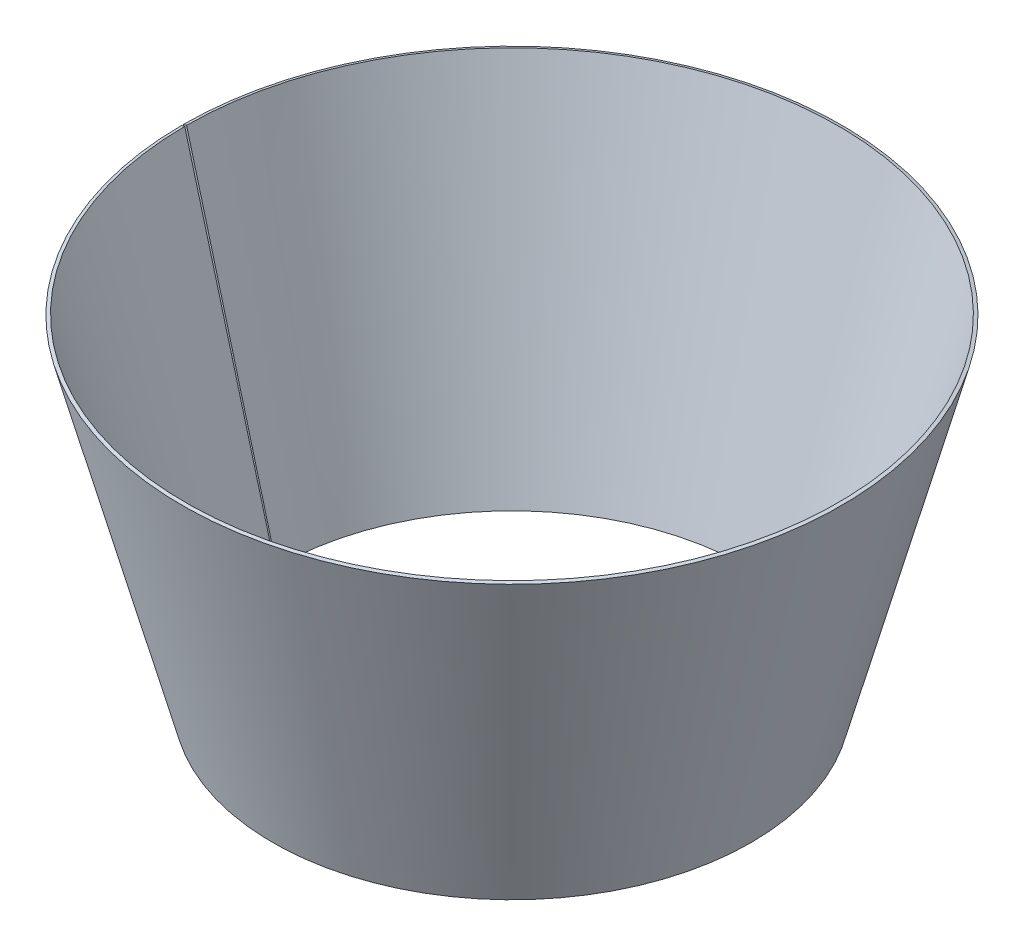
SolidWorks part; units mm, degrees
ref_plane "Ebene vorne" through (0, 0, 0) normal (0, 0, 1) x (1, 0, 0)
ref_plane "Ebene oben" through (0, 0, 0) normal (0, 1, 0) x (1, 0, 0)
ref_plane "Ebene rechts" through (0, 0, 0) normal (1, 0, 0) x (0, 0, -1)
sketch "Skizze1" plane through (0, 0, 0) normal (0, 0, 1) x (1, 0, 0)
  line L0 (0, 0) -> (0, 100) construction
  line L1 (-96.7949, 100) -> (-70, 0)
  line L2 (0, 0) -> (-70, 0) construction
  dimension "D1" = 100
  dimension "D2" = 15
  dimension "D3" = 70
revolve "Rotation-Dünn1" add sketch "Skizze1" angle 360 about L0
sketch "Skizze2" plane through (0, 0, 0) normal (0, 1, 0) x (1, 0, 0)
  line L0 (0, 0) -> (-96.7949, 0) construction
  line L1 (-171.9387, 0.5) -> (0, 0)
  line L2 (-171.9387, 0.5) -> (-171.9387, -0.5)
  line L3 (-171.9387, -0.5) -> (0, 0)
  circle A0 centre (0, 0) radius 96.7949 construction
  dimension "D1" = 1
extrude "Schnitt-Linear austragen2" cut sketch "Skizze2" along normal through all and the other way through all
sheet metal parameters "Blech4" parameters "D1"=0.3, "Dicke"=1
bend "Biegung-Rundung2" bend radius 96.7949 bend angle 359.667 parameters "D5"=1
flatten bends "Abwickeln4" parameters "D1"=0
sketch "Skizze-Winkel4" plane through (-84.363, 49.7412, -0.2453) normal (-0.9659, -0.2588, -0.0028) x (-0.0027, -0.0007, 1)
  line L0 (-198.9338, -137.5179) -> (-274.1387, -66.3688) construction
process bends "Abbiegen4" parameters "D1"=0
sketch "Abwicklung-Skizze4" plane through (-84.363, 49.7412, -0.2453) normal (-0.9659, -0.2588, -0.0028) x (-0.0027, -0.0007, 1)
equation "\"LÄNGE\"=0"
equation "\"BREITE\"=0"
equation "\"HÖHE\"=0"
equation "\"DURCHMESSER\"=0"
equation "\"Stückzahl\"= 1"
